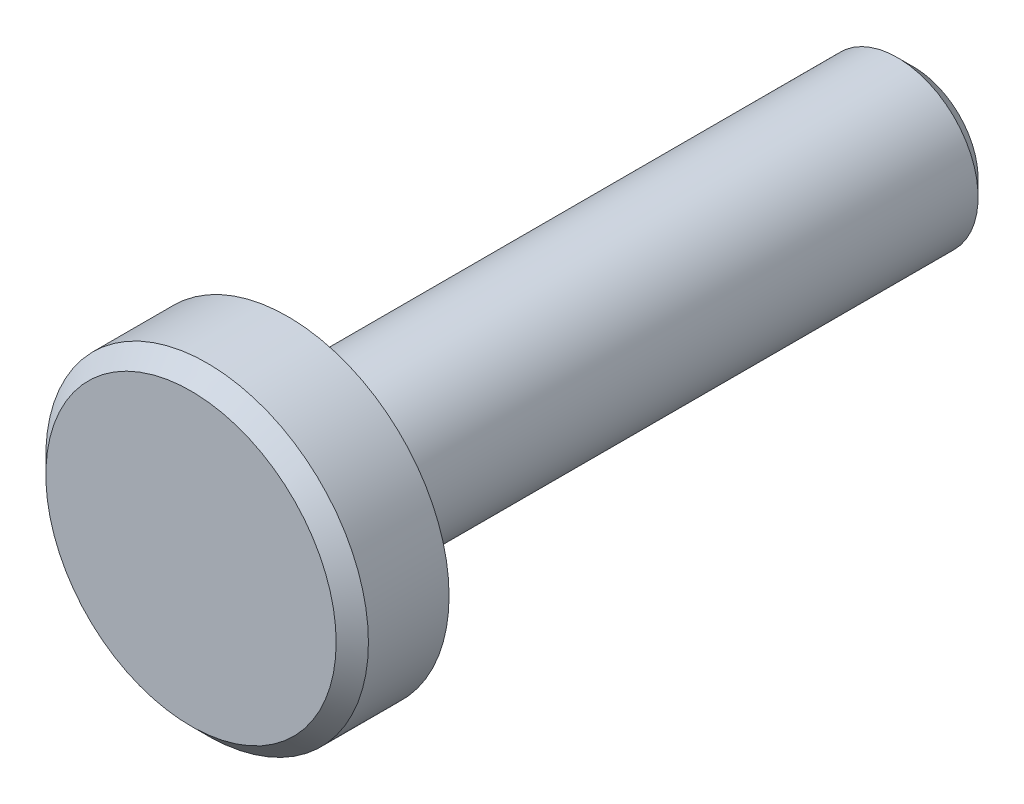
SolidWorks part; units mm, degrees
ref_plane "XZ (Face)" through (0, 0, 0) normal (0, 0, 1) x (1, 0, 0)
ref_plane "XY (Dessus)" through (0, 0, 0) normal (0, 1, 0) x (1, 0, 0)
ref_plane "YZ (Droite)" through (0, 0, 0) normal (1, 0, 0) x (0, 0, -1)
sketch "Esquisse1" plane through (0, 0, 0) normal (0, 0, 1) x (1, 0, 0)
  circle A0 centre (-14.011, -19.5) radius 1.25 construction
  circle A1 centre (-14.011, -19.5) radius 1.25
extrude "Base-Extrusion" add sketch "Esquisse1" along normal blind 5.7 and the other way up to surface
sketch "Esquisse2" plane through (0, 0, 5.7) normal (0, 0, 1) x (1, 0, 0)
  circle A2 centre (-14.011, -19.5) radius 2.5
  circle A3 centre (-14.011, -19.5) radius 2.5
  dimension "D1" = 1.25
extrude "Boss.-Extru.1" add sketch "Esquisse2" along normal blind 1.5
chamfer "Chanfrein1" distance 0.25 angle 45
